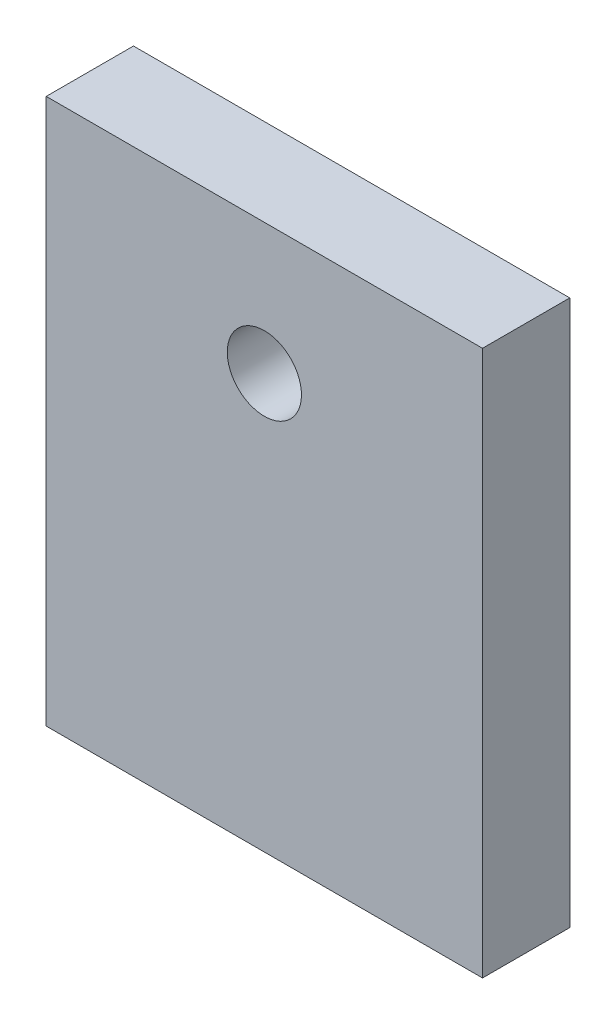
SolidWorks part; units mm, degrees
ref_plane "Plan de face" through (0, 0, 0) normal (0, 0, 1) x (1, 0, 0)
ref_plane "Plan de dessus" through (0, 0, 0) normal (0, 1, 0) x (1, 0, 0)
ref_plane "Plan de droite" through (0, 0, 0) normal (1, 0, 0) x (0, 0, -1)
sketch "Esquisse1" plane through (0, 0, 0) normal (0, 1, 0) x (1, 0, 0)
  line L1 (0, 0) -> (50, 0)
  line L2 (0, 0) -> (0, 10)
  line L3 (0, 10) -> (50, 10)
  line L4 (50, 0) -> (50, 10)
  dimension "D1" = 50
  dimension "D2" = 10
extrude "Extrusion1" add sketch "Esquisse1" along normal blind 62.5
hole_wizard "Trou taraudé M101" positions "Esquisse3" profile "Esquisse2" tap size "M10" standard "ISO"
sketch "Esquisse3" plane through (0, 0, -10) normal (0, 0, -1) x (-1, 0, 0)
  line L1 (-50, 62.5) -> (0, 62.5) construction
  line L2 (0, 62.5) -> (0, 0) construction
  point P0 (-25, 47.5)
  dimension "D1" = 25
  dimension "D2" = 15
sketch "Esquisse2" plane through (25, 47.5, -10) normal (1, 0, 0) x (0, 1, 0)
  line L0 (0, 0) -> (0, 10)
  line L1 (0, 10) -> (4.25, 10)
  line L2 (4.25, 10) -> (4.25, 0)
  line L5 (4.25, 0) -> (0, 0)
  line L11 (0, -6.35) -> (0, 107.95) construction
  dimension "Diamètre du trou pour taraudage jusqu'au prochain" = 8.5
  dimension "Profondeur du trou pour taraudage jusqu'au prochain" = 10
